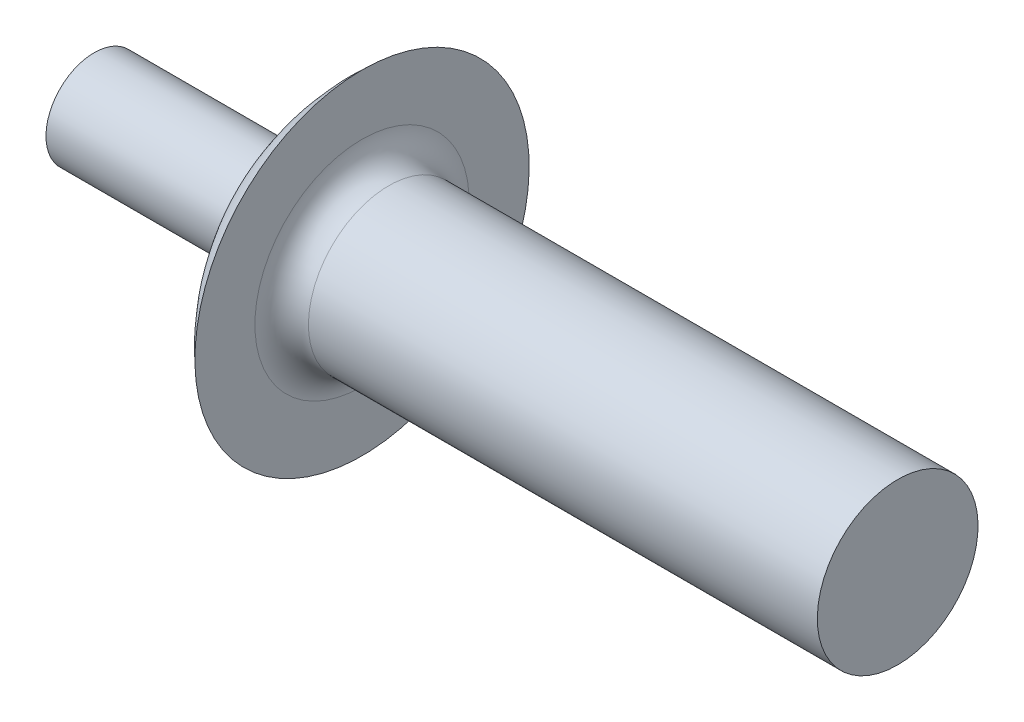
SolidWorks part; units mm, degrees
ref_plane "Front" through (0, 0, 0) normal (0, 0, 1) x (1, 0, 0)
ref_plane "Top" through (0, 0, 0) normal (0, 1, 0) x (1, 0, 0)
ref_plane "Right" through (0, 0, 0) normal (1, 0, 0) x (0, 0, -1)
sketch "Sketch1" plane through (13.2414, 10.1214, 0) normal (0, 0, 1) x (0, 1, 0)
  line L0 (-10.1214, -1.7586) -> (-8.6214, -1.7586)
  line L1 (-8.6214, -1.7586) -> (-8.6214, 8.2414)
  line L2 (-8.6214, 8.2414) -> (-7.0014, 8.2414)
  line L3 (-10.1214, 34.3377) -> (-10.1214, -10.975) construction
  line L4 (-9.2214, 9.5432) -> (-9.2214, 13.2414)
  line L5 (-9.2214, 13.2414) -> (-10.1214, 13.2414)
  line L6 (-10.1214, -1.7586) -> (-10.1214, 13.2414)
  arc A0 (-7.0014, 8.2414) -> (-9.2214, 9.5432) centre (-10.1214, 5.4648) ccw
  dimension "l" = 10
  dimension "D2" = 5
  dimension "d" = 3
  dimension "dk" = 6.24
  dimension "d1" = 1.8
  dimension "K" = 1.4
revolve "Base-Revolve" add sketch "Sketch1" angle 360 about L3
fillet "Fillet1" radius 0.5 1 edges at (5, -1.5, 0)
equation "\"D2@Sketch1\" = \"l@Sketch1\" / 2"
